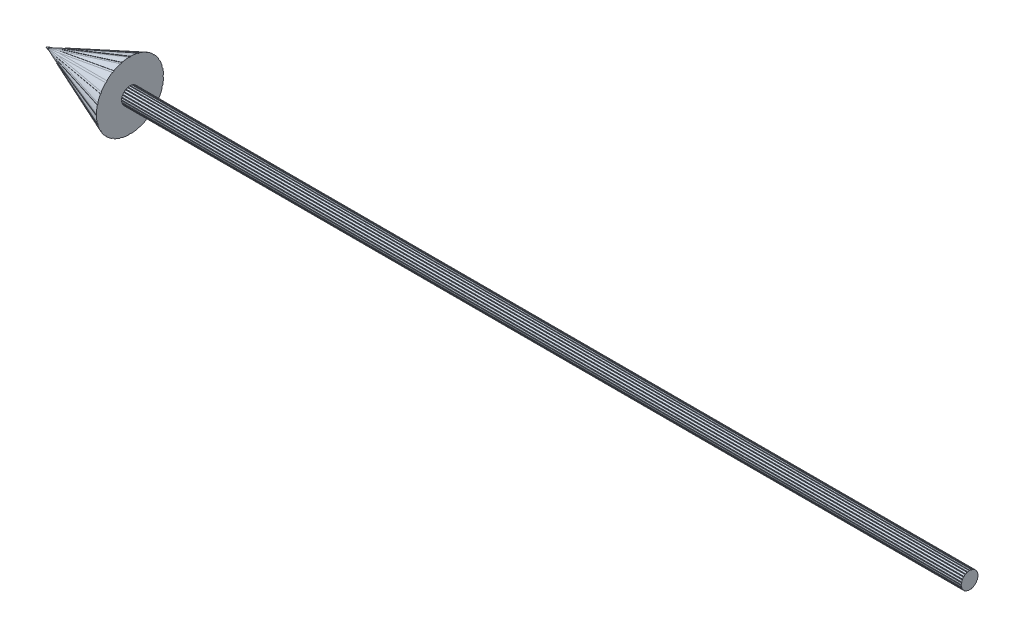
SolidWorks part; units mm, degrees
ref_plane "Face" through (0, 0, 0) normal (0, 0, 1) x (1, 0, 0)
ref_plane "Dessus" through (0, 0, 0) normal (0, 1, 0) x (1, 0, 0)
ref_plane "Droite" through (0, 0, 0) normal (1, 0, 0) x (0, 0, -1)
sketch "Esquisse1" plane through (0, 0, 0) normal (1, 0, 0) x (0, 0, -1)
  circle A0 centre (0, 0) radius 0.5
  dimension "D1" = 1
extrude "Boss.-Extru.1" add sketch "Esquisse1" along normal blind 50
sketch "Esquisse2" plane through (0, 0, 0) normal (0, 0, 1) x (1, 0, 0)
  line L0 (0, 0) -> (-11.2925, 0) construction
  line L1 (0, 0) -> (0, 2)
  line L2 (0, 2) -> (-5, 0)
  line L3 (-5, 0) -> (0, 0)
  dimension "D1" = 5
  dimension "D2" = 4
revolve "Révolution1" add sketch "Esquisse2" angle 360 about L0
sketch "Esquisse3" plane through (50, 0, 0) normal (1, 0, 0) x (0, 0, -1)
  line L0 (0, 0.48) -> (-0.05, 0.53)
  line L1 (-0.05, 0.53) -> (0.05, 0.53)
  line L2 (0.05, 0.53) -> (0, 0.48)
  line L3 (0, 0) -> (0, 0.48) construction
  dimension "D1" = 0.1
  dimension "D2" = 0.48
  dimension "D3" = 90
extrude "Enlèv. mat.-Extru.1" cut sketch "Esquisse3" against normal up to surface (50 mm away)
pattern_circular "Répétition circulaire1" count 24 over 360 about axis through (0, 0, 0) along (1, 0, 0) of "Enlèv. mat.-Extru.1"
sketch "Esquisse4" plane through (0, 0, 0) normal (0, 0, 1) x (1, 0, 0)
  line L0 (0, 1.9785) -> (-4.7721, 0.0696)
  line L1 (-4.7721, 0.0696) -> (-4.826, 0.0696)
  line L2 (0, 2) -> (-5, 0) construction
  line L3 (-4.826, 0.0696) -> (0, 2)
  line L4 (0, 2) -> (0, 1.9785)
  line L8 (0, 0.0196) -> (-6.1417, 0.0196) construction
  dimension "D1" = 0.02
  dimension "D2" = 0.05
extrude "Enlèv. mat.-Extru.2" cut sketch "Esquisse4" against normal mid plane 0.1
pattern_circular "Répétition circulaire2" count 24 over 360 about axis through (0, 0, 0) along (1, 0, 0) of "Enlèv. mat.-Extru.2"
